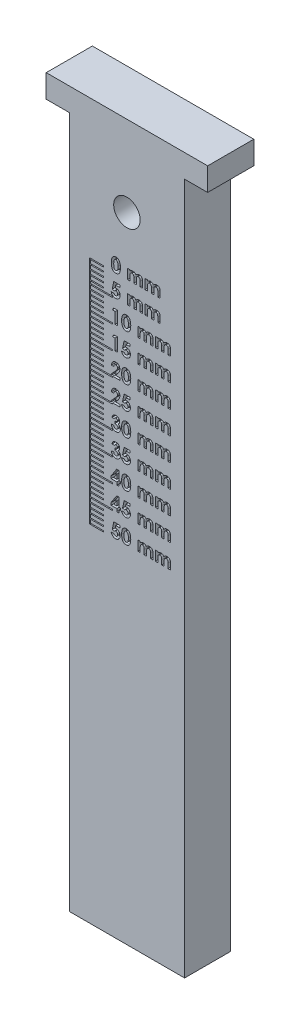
SolidWorks part; units mm, degrees
ref_plane "Front Plane" through (0, 0, 0) normal (0, 0, 1) x (1, 0, 0)
ref_plane "Top Plane" through (0, 0, 0) normal (0, 1, 0) x (1, 0, 0)
ref_plane "Right Plane" through (0, 0, 0) normal (1, 0, 0) x (0, 0, -1)
sketch "Sketch1" plane through (0, 0, 0) normal (0, 0, 1) x (1, 0, 0)
  line L1 (0, 0) -> (-25, 0)
  line L2 (0, 0) -> (0, 150)
  line L3 (0, 150) -> (-25, 150)
  line L4 (-25, 0) -> (-25, 150)
  dimension "D1" = 150
  dimension "D2" = 25
extrude "Boss-Extrude1" add sketch "Sketch1" along normal blind 10 contours L4 L3 L2 L1
sketch "Sketch2" plane through (0, 150, 0) normal (0, 1, 0) x (1, 0, 0)
  line L0 (-25, -10) -> (-25, 0) construction
  line L1 (-30, 0) -> (5, 0)
  line L2 (-30, 0) -> (-30, -10)
  line L3 (-30, -10) -> (5, -10)
  line L4 (5, 0) -> (5, -10)
  line L6 (0, 0) -> (-25, 0) construction
  line L8 (0, -10) -> (-25, -10) construction
  point P8 (-25, -5)
  point P9 (-30, -5)
  point P12 (-12.5, 0)
  point P13 (-12.5, 0)
  dimension "D1" = 5
extrude "Boss-Extrude2" add sketch "Sketch2" along normal blind 5
ref_plane "Plane1" through (0, 0, 5) normal (0, 0, 1) x (1, 0, 0)
sketch "Sketch8" [suppressed] plane through (0, 0, 0) normal (0, 0, -1) x (-1, 0, 0)
  line L0 (25, 2.5) -> (25, 62.5)
sketch "Sketch5" plane through (0, 0, 5) normal (0, 0, 1) x (1, 0, 0)
  line L1 (-30, 150) -> (-25, 150) construction
  line L2 (-15.375, 137.5) -> (-12.5, 137.5) construction
  line L4 (-12.5, 137.5) -> (-9.625, 137.5) construction
  line L5 (-25, 137.5) -> (0, 137.5) construction
  line L6 (0, 0) -> (0, 150) construction
  line L7 (-25, 0) -> (-25, 150) construction
  circle A0 centre (-12.5, 137.5) radius 2.875
  dimension "D1" = 5.75
  dimension "D2" = 12.5
extrude "Cut-Extrude2" cut sketch "Sketch5" against normal mid plane 10
sketch "Sketch9" plane through (0, 0, 5) normal (0, 0, 1) x (1, 0, 0)
  line L0 (-25, 2.5) -> (-25, 111.5) construction
  line L1 (-25, 0) -> (-25, 150) construction
  line L2 (-25, 111.5) -> (-20.141, 111.5)
  line L3 (-20.141, 111.5) -> (-19.641, 111)
  line L4 (-19.641, 111) -> (-20.141, 110.5)
  line L5 (-20.141, 110.5) -> (-22.5705, 110.5)
  line L6 (-22.5705, 110.5) -> (-22.5705, 109.5)
  line L7 (-25, 111.5) -> (-25, 109.5)
  line L8 (-22.5705, 109.5) -> (-25, 109.5)
  dimension "D1" = 109
  dimension "D2" = 1
  dimension "D3" = 1
  dimension "D4" = 0.7071
  dimension "D6" = 2.4295
  dimension "D7" = 2.9295
extrude "Cut-Extrude4" cut sketch "Sketch9" against normal mid plane 7
pattern_linear "LPattern13" count 50 spacing 2 along (0, -1, 0) of "Cut-Extrude4"
sketch "Sketch10" plane through (0, 0, 0) normal (0, 0, -1) x (-1, 0, 0)
  line L0 (25, 150) -> (9.1017, 150) construction
  line L1 (9.1017, 150) -> (9.1017, 124.95) construction
  line L2 (17.6017, 124.95) -> (17.6017, 74.95)
  line L3 (20.6017, 74.95) -> (20.6017, 124.95)
  line L4 (9.1017, 124.95) -> (9.1017, 74.95)
  line L5 (17.6017, 123.95) -> (20.6017, 123.95)
  line L6 (17.6017, 74.95) -> (20.6017, 74.95)
  line L7 (17.6017, 122.95) -> (20.6017, 122.95)
  line L8 (17.6017, 121.95) -> (20.6017, 121.95)
  line L9 (15.6017, 74.95) -> (17.6017, 74.95)
  line L10 (17.6017, 120.95) -> (20.6017, 120.95)
  line L11 (20.6017, 119.95) -> (15.6017, 119.95)
  line L12 (15.6017, 119.95) -> (9.1017, 119.95) construction
  line L13 (15.6017, 74.95) -> (9.1017, 74.95) construction
  line L14 (17.6017, 124.95) -> (20.6017, 124.95)
  line L15 (20.6017, 115.95) -> (17.6017, 115.95)
  line L16 (20.6017, 116.95) -> (17.6017, 116.95)
  line L17 (20.6017, 117.95) -> (17.6017, 117.95)
  line L18 (20.6017, 118.95) -> (17.6017, 118.95)
  line L19 (20.6017, 114.95) -> (15.6017, 114.95)
  line L20 (25, 0) -> (25, 150) construction
  line L21 (15.6017, 114.95) -> (9.1017, 114.95) construction
  line L22 (9.1017, 124.95) -> (15.6017, 124.95) construction
  line L23 (20.6017, 110.95) -> (17.6017, 110.95)
  line L24 (20.6017, 111.95) -> (17.6017, 111.95)
  line L25 (20.6017, 112.95) -> (17.6017, 112.95)
  line L26 (20.6017, 113.95) -> (17.6017, 113.95)
  line L27 (20.6017, 109.95) -> (15.6017, 109.95)
  line L28 (15.6017, 109.95) -> (9.1017, 109.95) construction
  line L29 (20.6017, 108.95) -> (17.6017, 108.95)
  line L30 (20.6017, 107.95) -> (17.6017, 107.95)
  line L31 (20.6017, 106.95) -> (17.6017, 106.95)
  line L32 (20.6017, 105.95) -> (17.6017, 105.95)
  line L33 (20.6017, 104.95) -> (15.6017, 104.95)
  line L34 (15.6017, 104.95) -> (9.1017, 104.95) construction
  line L35 (20.6017, 103.95) -> (17.6017, 103.95)
  line L36 (20.6017, 102.95) -> (17.6017, 102.95)
  line L37 (20.6017, 101.95) -> (17.6017, 101.95)
  line L38 (20.6017, 100.95) -> (17.6017, 100.95)
  line L39 (20.6017, 99.95) -> (15.6017, 99.95)
  line L40 (15.6017, 99.95) -> (9.1017, 99.95) construction
  line L41 (20.6017, 98.95) -> (17.6017, 98.95)
  line L42 (20.6017, 97.95) -> (17.6017, 97.95)
  line L43 (20.6017, 96.95) -> (17.6017, 96.95)
  line L44 (20.6017, 95.95) -> (17.6017, 95.95)
  line L45 (20.6017, 94.95) -> (15.6017, 94.95)
  line L46 (15.6017, 94.95) -> (9.1017, 94.95) construction
  line L47 (20.6017, 93.95) -> (17.6017, 93.95)
  line L48 (20.6017, 92.95) -> (17.6017, 92.95)
  line L49 (20.6017, 91.95) -> (17.6017, 91.95)
  line L50 (20.6017, 90.95) -> (17.6017, 90.95)
  line L51 (20.6017, 89.95) -> (15.6017, 89.95)
  line L52 (15.6017, 89.95) -> (9.1017, 89.95) construction
  line L53 (20.6017, 88.95) -> (17.6017, 88.95)
  line L54 (20.6017, 87.95) -> (17.6017, 87.95)
  line L55 (20.6017, 86.95) -> (17.6017, 86.95)
  line L56 (20.6017, 85.95) -> (17.6017, 85.95)
  line L57 (20.6017, 84.95) -> (15.6017, 84.95)
  line L58 (15.6017, 84.95) -> (9.1017, 84.95) construction
  line L59 (20.6017, 83.95) -> (17.6017, 83.95)
  line L60 (20.6017, 82.95) -> (17.6017, 82.95)
  line L61 (20.6017, 81.95) -> (17.6017, 81.95)
  line L62 (20.6017, 80.95) -> (17.6017, 80.95)
  line L63 (20.6017, 79.95) -> (15.6017, 79.95)
  line L64 (15.6017, 79.95) -> (9.1017, 79.95) construction
  line L65 (20.6017, 78.95) -> (17.6017, 78.95)
  line L66 (20.6017, 77.95) -> (17.6017, 77.95)
  line L67 (20.6017, 76.95) -> (17.6017, 76.95)
  line L68 (20.6017, 75.95) -> (17.6017, 75.95)
  line L69 (15.6017, 124.95) -> (17.6017, 124.95)
  dimension "D1" = 25.05
  dimension "D3" = 50
  dimension "D4" = 2
  dimension "D5" = 1
  dimension "D6" = 1
  dimension "D7" = 1
  dimension "D8" = 1
  dimension "D9" = 5
  dimension "D11" = 5
  dimension "D12" = 4.3983
  dimension "D13" = 6.5
  dimension "D14" = 6.5
  dimension "D15" = 4.3983
  dimension "D17" = 6.5
  dimension "D18" = 1
  dimension "D19" = 1
  dimension "D20" = 1
  dimension "D21" = 1
  dimension "D22" = 1
  dimension "D23" = 5
  dimension "D24" = 6.5
  dimension "D25" = 1
  dimension "D26" = 5
  dimension "D27" = 5
  dimension "D28" = 1
  dimension "D29" = 1
  dimension "D30" = 1
  dimension "D31" = 1
  dimension "D32" = 3
  dimension "D33" = 5
  dimension "D34" = 5
  dimension "D35" = 5
  dimension "D36" = 5
sketch "Sketch12"
  dimension "D1" = 4
  dimension "D2" = 4
  dimension "D3" = 4
  dimension "D4" = 4
  dimension "D5" = 4
  dimension "D6" = 4
  dimension "D7" = 9
  dimension "D8" = 9
  dimension "D9" = 9
  dimension "D10" = 4
  dimension "D11" = 9
  dimension "D12" = 4
  dimension "D13" = 9
  dimension "D14" = 4
  dimension "D15" = 9
  dimension "D16" = 4
  dimension "D17" = 5
extrude "Cut-Extrude6" cut sketch "Sketch12" against normal blind 1
extrude "Cut-Extrude-Thin10" cut sketch "Sketch10" against normal blind 1 thin contours L14 L3 L6 | L5 | L7 | L8 | L10 | L11 | L18 | L17 | L16 | L15 | L19 | L68 | L67 | L66 | L65 | L63 | L62 | L61 | L60 | L59 | L57 | L56 | L55 | L54 | L53 | L51 | L50 | L49 | L48 | L47 | L45 | L44 | L43 | L42 | L41 | L39 | L38 | L37 | L36 | L35 | L33 | L32 | L31 | L30 | L29 | L27 | L23 | L24 | L25 | L26
mirror "Mirror4" about plane through (0, 0, 5) normal (0, 0, 1) of "Cut-Extrude-Thin10"
sketch "Sketch17" plane through (0, 0, 10) normal (0, 0, 1) x (1, 0, 0)
  line L0 (-16, 124.95) -> (-4, 124.95) construction
  line L1 (0, 0) -> (0, 150) construction
  line L2 (-25, 0) -> (-25, 150) construction
  line L3 (-16, 120.2) -> (-4, 120.2) construction
  line L4 (-16, 115.2) -> (-4, 115.2) construction
  line L5 (-16, 110.2) -> (-4, 110.2) construction
  line L6 (-16, 105.2) -> (-4, 105.2) construction
  line L7 (-16, 100.2) -> (-4, 100.2) construction
  line L8 (-16, 95.2) -> (-4, 95.2) construction
  line L9 (-16, 90.2) -> (-4, 90.2) construction
  line L10 (-16, 85.2) -> (-4, 85.2) construction
  line L11 (-16, 80.2) -> (-4, 80.2) construction
  line L12 (-16, 75.071) -> (-4, 75.071) construction
  text T0 "<b>0 mm</b>" font "Century Gothic" height in points 11
  text T1 "<b>5 mm</b>" font "Century Gothic" height in points 11
  text T2 "<b>10 mm</b>" font "Century Gothic" height in points 11
  text T3 "<b>15 mm</b>" font "Century Gothic" height in points 11
  text T4 "<b>20 mm</b>" font "Century Gothic" height in points 11
  text T5 "<b>25 mm</b>" font "Century Gothic" height in points 11
  text T6 "<b>30 mm</b>" font "Century Gothic" height in points 11
  text T7 "<b>35 mm</b>" font "Century Gothic" height in points 11
  text T8 "<b>40 mm</b>  " font "Century Gothic" height in points 11
  text T9 "<b>45 mm</b>" font "Century Gothic" height in points 11
  text T10 "<b>50 mm</b>" font "Century Gothic" height in points 11
  dimension "D1" = 4
  dimension "D2" = 9
  dimension "D3" = 9
extrude "Cut-Extrude7" cut sketch "Sketch17" against normal blind 1
